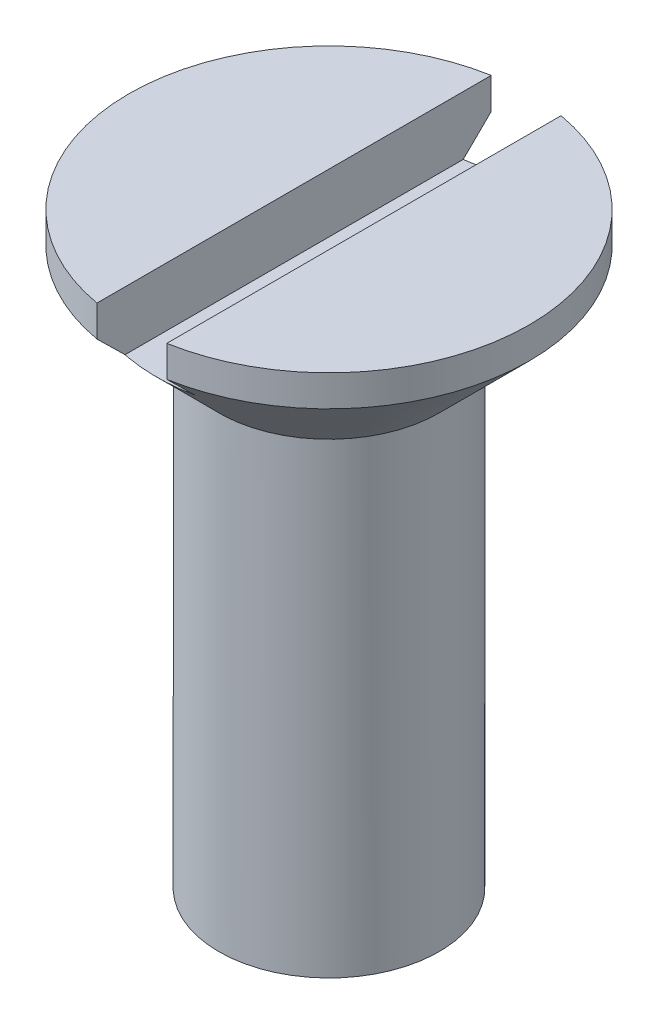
SolidWorks part; units mm, degrees
ref_plane "Front Plane" through (0, 0, 0) normal (0, 0, 1) x (1, 0, 0)
ref_plane "Top Plane" through (0, 0, 0) normal (0, 1, 0) x (1, 0, 0)
ref_plane "Right Plane" through (0, 0, 0) normal (1, 0, 0) x (0, 0, -1)
sketch "Sketch1" plane through (0, 0, 0) normal (0, 0, -1) x (1, 0, 0)
  line L0 (3, -14.4321) -> (5.45, -16.8821)
  line L1 (5.45, -16.8821) -> (5.45, -17.7321)
  line L2 (-3, -14.4321) -> (-5.45, -16.8821) construction
  line L3 (-5.45, -16.8821) -> (-5.45, -17.7321) construction
  line L22 (0, 0) -> (0, -23.1454) construction
  line L23 (0, 0) -> (0, -17.7321)
  line L24 (0, -17.7321) -> (5.45, -17.7321)
  line L26 (3, -1.7321) -> (0, 0)
  line L27 (3, -14.4321) -> (3, -1.7321)
  dimension "D2" = 3.3
  dimension "D3" = 10.9
  dimension "D4" = 6
  dimension "D5" = 6
  dimension "D6" = 16
  dimension "D7" = 90
  dimension "D10" = 120
revolve "Revolve1" add sketch "Sketch1" angle 360 about L22
sketch "Sketch2" plane through (0, 0, 0) normal (0, 0, 1) x (1, 0, 0)
  line L0 (5.45, 17.7321) -> (-5.45, 17.7321) construction
  line L1 (-0.95, 17.7321) -> (0.95, 17.7321)
  line L2 (-0.95, 17.7321) -> (-0.95, 16.1321)
  line L3 (-0.95, 16.1321) -> (0.95, 16.1321)
  line L4 (0.95, 17.7321) -> (0.95, 16.1321)
  line L5 (0, 17.7321) -> (0, -6.9039) construction
  dimension "D1" = 1.9
  dimension "D2" = 1.6
extrude "Cut-Extrude1" cut sketch "Sketch2" against normal through all both and the other way through all
